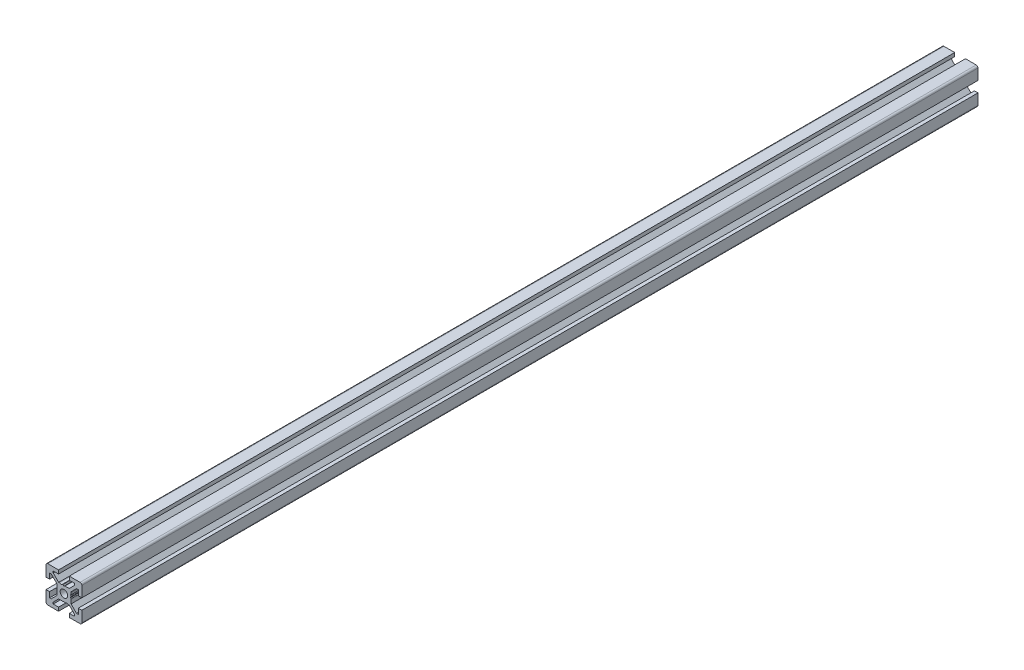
SolidWorks part; units mm, degrees
ref_plane "正面" through (0, 0, 0) normal (0, 0, 1) x (1, 0, 0)
ref_plane "平面" through (0, 0, 0) normal (0, 1, 0) x (1, 0, 0)
ref_plane "右側面" through (0, 0, 0) normal (1, 0, 0) x (0, 0, -1)
ref_plane "平面1" through (0, 0, -500) normal (0, 0, -1) x (-1, 0, 0)
sketch "ｽｹｯﾁ1" plane through (0, 0, -500) normal (0, 0, -1) x (-1, 0, 0)
  line L0 (10, -3) -> (8, -3)
  line L1 (8, -3) -> (8, -6)
  line L2 (8, -6) -> (7.0607, -6)
  line L3 (7.0607, -6) -> (4, -2.9393)
  line L4 (4, -2.9393) -> (4, -2.5)
  line L5 (4, -2.5) -> (3.751, -1.2189)
  line L6 (3.751, -1.2189) -> (3.933, -0.9036)
  line L7 (3.933, -0.4036) -> (3.7, 0)
  line L8 (3.7, 0) -> (3.933, 0.4036)
  line L9 (4, 0.6536) -> (4, 2.9393)
  line L10 (4, 2.9393) -> (7.0607, 6)
  line L11 (7.0607, 6) -> (8, 6)
  line L12 (8, 6) -> (8, 3)
  line L13 (8, 3) -> (10, 3)
  line L14 (10, 3) -> (10, 9)
  line L15 (9, 10) -> (3, 10)
  line L16 (3, 10) -> (3, 8)
  line L17 (3, 8) -> (6, 8)
  line L18 (6, 8) -> (6, 7.0607)
  line L19 (6, 7.0607) -> (2.9393, 4)
  line L20 (2.9393, 4) -> (2.5, 4)
  line L21 (2.5, 4) -> (1.2189, 3.751)
  line L22 (1.2189, 3.751) -> (0.9036, 3.933)
  line L23 (0.4036, 3.933) -> (0, 3.7)
  line L24 (0, 3.7) -> (-0.4036, 3.933)
  line L25 (-0.6536, 4) -> (-2.9393, 4)
  line L26 (-2.9393, 4) -> (-6, 7.0607)
  line L27 (-6, 7.0607) -> (-6, 8)
  line L28 (-6, 8) -> (-3, 8)
  line L29 (-3, 8) -> (-3, 10)
  line L30 (-3, 10) -> (-9, 10)
  line L31 (-10, 9) -> (-10, 3)
  line L32 (-10, 3) -> (-8, 3)
  line L33 (-8, 3) -> (-8, 6)
  line L34 (-8, 6) -> (-7.0607, 6)
  line L35 (-7.0607, 6) -> (-4, 2.9393)
  line L36 (-4, 2.9393) -> (-4, 2.5)
  line L37 (-4, 2.5) -> (-3.751, 1.2189)
  line L38 (-3.751, 1.2189) -> (-3.933, 0.9036)
  line L39 (-3.933, 0.4036) -> (-3.7, 0)
  line L40 (-3.7, 0) -> (-3.933, -0.4036)
  line L41 (-4, -0.6536) -> (-4, -2.9393)
  line L42 (-4, -2.9393) -> (-7.0607, -6)
  line L43 (-7.0607, -6) -> (-8, -6)
  line L44 (-8, -6) -> (-8, -3)
  line L45 (-8, -3) -> (-10, -3)
  line L46 (-10, -3) -> (-10, -9)
  line L47 (-9, -10) -> (-3, -10)
  line L48 (-3, -10) -> (-3, -8)
  line L49 (-3, -8) -> (-6, -8)
  line L50 (-6, -8) -> (-6, -7.0607)
  line L51 (-6, -7.0607) -> (-2.9393, -4)
  line L52 (-2.9393, -4) -> (-2.5, -4)
  line L53 (-2.5, -4) -> (-1.2189, -3.751)
  line L54 (-1.2189, -3.751) -> (-0.9036, -3.933)
  line L55 (-0.4036, -3.933) -> (0, -3.7)
  line L56 (0, -3.7) -> (0.4036, -3.933)
  line L57 (0.6536, -4) -> (2.9393, -4)
  line L58 (2.9393, -4) -> (6, -7.0607)
  line L59 (6, -7.0607) -> (6, -8)
  line L60 (6, -8) -> (3, -8)
  line L61 (3, -8) -> (3, -10)
  line L62 (3, -10) -> (9, -10)
  line L63 (10, -9) -> (10, -3)
  circle A0 centre (0, 0) radius 2.1
  arc A1 (3.933, -0.9036) -> (3.933, -0.4036) centre (3.5, -0.6536) ccw
  arc A2 (3.933, 0.4036) -> (4, 0.6536) centre (3.5, 0.6536) ccw
  arc A3 (10, 9) -> (9, 10) centre (9, 9) ccw
  arc A4 (0.9036, 3.933) -> (0.4036, 3.933) centre (0.6536, 3.5) ccw
  arc A5 (-0.4036, 3.933) -> (-0.6536, 4) centre (-0.6536, 3.5) ccw
  arc A6 (-9, 10) -> (-10, 9) centre (-9, 9) ccw
  arc A7 (-3.933, 0.9036) -> (-3.933, 0.4036) centre (-3.5, 0.6536) ccw
  arc A8 (-3.933, -0.4036) -> (-4, -0.6536) centre (-3.5, -0.6536) ccw
  arc A9 (-10, -9) -> (-9, -10) centre (-9, -9) ccw
  arc A10 (-0.9036, -3.933) -> (-0.4036, -3.933) centre (-0.6536, -3.5) ccw
  arc A11 (0.4036, -3.933) -> (0.6536, -4) centre (0.6536, -3.5) ccw
  arc A12 (9, -10) -> (10, -9) centre (9, -9) ccw
extrude "ﾎﾞｽ - 押し出し1" add sketch "ｽｹｯﾁ1" against normal blind 500
